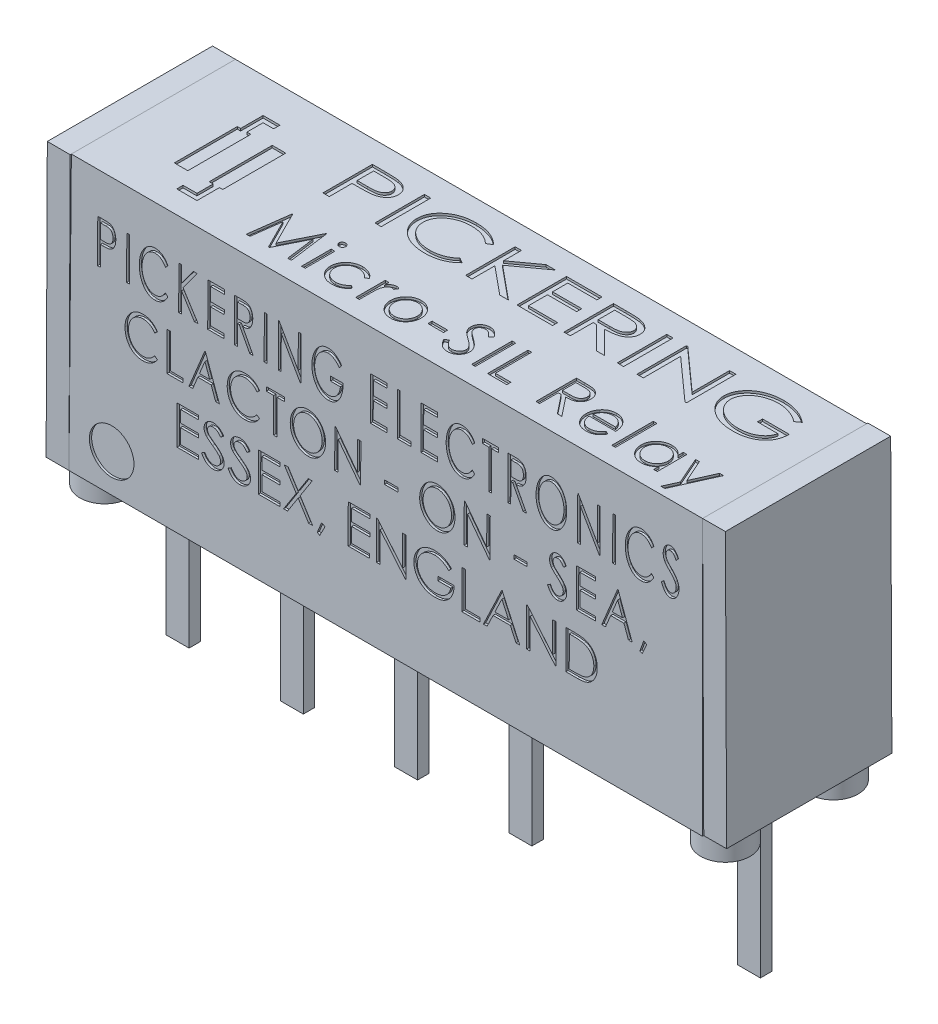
SolidWorks part; units mm, degrees
ref_plane "Front Plane" through (0, 0, 0) normal (0, 0, 1) x (1, 0, 0)
ref_plane "Top Plane" through (0, 0, 0) normal (0, 1, 0) x (1, 0, 0)
ref_plane "Right Plane" through (0, 0, 0) normal (1, 0, 0) x (0, 0, -1)
sketch "Sketch1" plane through (0, 0, 0) normal (0, 1, 0) x (1, 0, 0)
  line L1 (7.042, -1.85) -> (-7.042, -1.85)
  line L2 (7.042, -1.85) -> (7.042, 1.85)
  line L3 (7.042, 1.85) -> (-7.042, 1.85)
  line L4 (-7.042, -1.85) -> (-7.042, 1.85)
  line L5 (7.042, -1.85) -> (-7.042, 1.85) construction
  line L6 (7.042, 1.85) -> (-7.042, -1.85) construction
  point P0 (0, 0)
  dimension "D1" = 3.7
  dimension "D2" = 14.084
extrude "Main body" add sketch "Sketch1" along normal blind 6.092 draft 0.25
sketch "Sketch2" plane through (-7.0419, 0.0307, 0) normal (-1, 0.0044, 0) x (0, 0, 1)
  line L1 (-1.8234, 6.0613) -> (1.85, 6.0613)
  line L2 (-1.8234, 6.0613) -> (-1.8234, -0.0307)
  line L3 (-1.8234, -0.0307) -> (1.85, -0.0307)
  line L4 (1.85, 6.0613) -> (1.85, -0.0307)
  dimension "D1" = 6.092
extrude "side 1" add sketch "Sketch2" along normal blind 0.508 separate body
sketch "Sketch3" plane through (7.0419, 0.0307, 0) normal (1, 0.0044, 0) x (0, 0, -1)
  line L0 (-1.85, -0.0307) -> (1.85, -0.0307) construction
  line L1 (-1.8234, 6.0613) -> (1.85, 6.0613)
  line L2 (-1.8234, 6.0613) -> (-1.8234, -0.0307)
  line L3 (-1.8234, -0.0307) -> (1.85, -0.0307)
  line L4 (1.85, 6.0613) -> (1.85, -0.0307)
extrude "side 2" add sketch "Sketch3" along normal blind 0.508 separate body
sketch "Sketch4" plane through (0, 0, 0) normal (0, -1, 0) x (1, 0, 0)
  line L3 (-7.042, 1.85) -> (7.042, 1.85) construction
  line L4 (-7.55, -1.8234) -> (-7.55, 1.85) construction
  line L5 (7.042, -1.85) -> (-7.042, -1.85) construction
  line L6 (7.55, 1.8234) -> (7.55, -1.85) construction
  circle A0 centre (-6.9, 1.2) radius 0.55
  circle A1 centre (-6.9, -1.2) radius 0.55
  circle A2 centre (6.9, 1.2) radius 0.55
  circle A3 centre (6.9, -1.2) radius 0.55
  dimension "D1" = 1.1
  dimension "D2" = 0.65
  dimension "D3" = 0.65
  dimension "D4" = 1.1
  dimension "D5" = 0.65
  dimension "D6" = 0.65
  dimension "D7" = 1.1
  dimension "D8" = 0.65
  dimension "D9" = 1.1
extrude "Feet" add sketch "Sketch4" along normal blind 0.508 separate body
sketch "Sketch5" plane through (0, 0, 0) normal (0, -1, 0) x (1, 0, 0)
  line L1 (-6.096, -0.127) -> (-6.604, -0.127)
  line L2 (-6.096, -0.127) -> (-6.096, 0.127)
  line L3 (-6.096, 0.127) -> (-6.604, 0.127)
  line L4 (-6.604, -0.127) -> (-6.604, 0.127)
  line L5 (-6.096, -0.127) -> (-6.604, 0.127) construction
  line L6 (-6.096, 0.127) -> (-6.604, -0.127) construction
  line L7 (-1.016, -0.127) -> (-1.524, -0.127)
  line L8 (-1.016, -0.127) -> (-1.016, 0.127)
  line L9 (-1.016, 0.127) -> (-1.524, 0.127)
  line L10 (-1.524, -0.127) -> (-1.524, 0.127)
  line L11 (-1.016, -0.127) -> (-1.524, 0.127) construction
  line L12 (-1.016, 0.127) -> (-1.524, -0.127) construction
  line L13 (1.016, -0.127) -> (1.524, -0.127)
  line L14 (1.016, -0.127) -> (1.016, 0.127)
  line L15 (1.016, 0.127) -> (1.524, 0.127)
  line L16 (1.524, -0.127) -> (1.524, 0.127)
  line L17 (1.016, -0.127) -> (1.524, 0.127) construction
  line L18 (1.016, 0.127) -> (1.524, -0.127) construction
  line L19 (6.604, -0.127) -> (6.096, -0.127)
  line L20 (6.604, -0.127) -> (6.604, 0.127)
  line L21 (6.604, 0.127) -> (6.096, 0.127)
  line L22 (6.096, -0.127) -> (6.096, 0.127)
  line L23 (6.604, -0.127) -> (6.096, 0.127) construction
  line L24 (6.604, 0.127) -> (6.096, -0.127) construction
  line L26 (-3.556, -0.127) -> (-4.064, -0.127)
  line L27 (-3.556, -0.127) -> (-3.556, 0.127)
  line L28 (-3.556, 0.127) -> (-4.064, 0.127)
  line L29 (-4.064, -0.127) -> (-4.064, 0.127)
  line L30 (-3.556, -0.127) -> (-4.064, 0.127) construction
  line L31 (-3.556, 0.127) -> (-4.064, -0.127) construction
  point P0 (-6.35, 0)
  point P5 (-1.27, 0)
  point P10 (1.27, 0)
  point P16 (6.35, 0)
  point P23 (-3.81, 0)
  dimension "D1" = 0.508
  dimension "D2" = 0.254
  dimension "D3" = 0.508
  dimension "D4" = 0.254
  dimension "D5" = 0.254
  dimension "D6" = 0.254
  dimension "D7" = 0.508
  dimension "D8" = 0.508
  dimension "D9" = 5.08
  dimension "D10" = 2.54
  dimension "D11" = 5.08
  dimension "D12" = 6.35
  dimension "D13" = 0.254
  dimension "D14" = 0.508
  dimension "D15" = 2.54
extrude "Pins" add sketch "Sketch5" along normal blind 3.808
sketch "Sketch7"
  dimension "D1" = 10.4
  dimension "D2" = 0.4
  dimension "D3" = 1.6
  dimension "D4" = 0.4
  dimension "D5" = 1
  dimension "D6" = 1.4
  dimension "D7" = 0.3
  dimension "D8" = 0.45
  dimension "D9" = 0.3
  dimension "D10" = 1.4
  dimension "D11" = 0.14
  dimension "D12" = 0.14
  dimension "D13" = 0.14
  dimension "D14" = 0.14
  dimension "D15" = 0.5
  dimension "D16" = 0.5
extrude "top face writing" cut sketch "Sketch7" against normal blind 0.05
sketch "Sketch8"
  dimension "D1" = 1.85
  dimension "D2" = 13.2
  dimension "D3" = 0.442
  dimension "D4" = 1.3
  dimension "D5" = 1.3
extrude "Address" cut sketch "Sketch8" against normal blind 0.05
sketch "Sketch9"
extrude "Relay type" add sketch "Sketch9" along normal blind 0.0001
